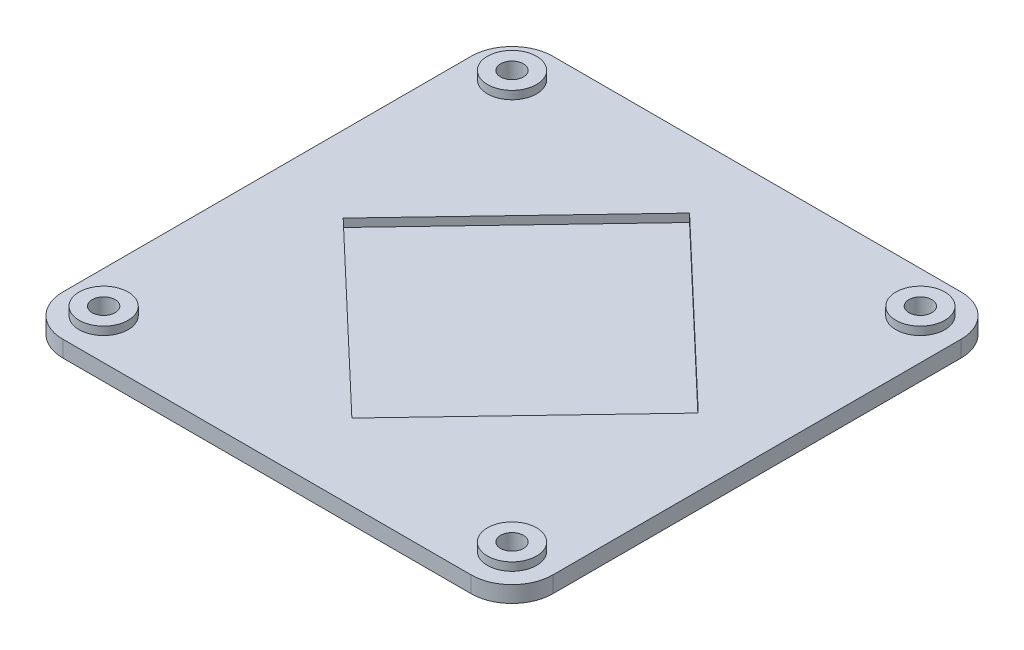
SolidWorks part; units mm, degrees
ref_plane "前视基准面" through (0, 0, 0) normal (0, 0, 1) x (1, 0, 0)
ref_plane "上视基准面" through (0, 0, 0) normal (0, 1, 0) x (1, 0, 0)
ref_plane "右视基准面" through (0, 0, 0) normal (1, 0, 0) x (0, 0, -1)
other "Configuration Table"
sketch "草图1" plane through (0, 0, 0) normal (0, 1, 0) x (1, 0, 0)
  line L1 (-30, 30) -> (30, 30)
  line L2 (-30, 30) -> (-30, -30)
  line L3 (-30, -30) -> (30, -30)
  line L4 (30, 30) -> (30, -30)
  line L5 (-30, 30) -> (30, -30) construction
  line L6 (-30, -30) -> (30, 30) construction
  point P0 (0, 0)
  dimension "D1" = 60
  dimension "D2" = 60
extrude "凸台-拉伸1" add sketch "草图1" along normal blind 2
fillet "圆角1" radius 5 4 edges at (30, 1, -30) (30, 1, 30) (-30, 1, 30) (-30, 1, -30)
sketch "草图2" plane through (0, 2, 0) normal (0, 1, 0) x (1, 0, 0)
  circle A0 centre (-25, 25) radius 3
  circle A1 centre (0, 0) radius 2.0608 construction
  circle A2 centre (25, 25) radius 3
  circle A3 centre (25, -25) radius 3
  circle A4 centre (-25, -25) radius 3
  point P14 (0, 0)
  dimension "D1" = 6
  dimension "D2" = 25
  dimension "D3" = 25
extrude "凸台-拉伸2" add sketch "草图2" along normal blind 1
sketch "草图3" plane through (0, 3, 0) normal (0, 1, 0) x (1, 0, 0)
  circle A0 centre (-25, 25) radius 1.4
  circle A1 centre (0, 0) radius 1.5251 construction
  circle A2 centre (25, 25) radius 1.4
  circle A3 centre (25, -25) radius 1.4
  circle A4 centre (-25, -25) radius 1.4
  point P15 (0, 0)
  dimension "D1" = 2.8
extrude "切除-拉伸1" cut sketch "草图3" against normal blind 6
sketch "草图6" plane through (0, 2, 0) normal (0, 1, 0) x (1, 0, 0)
  line L0 (0, 21.7394) -> (21.7394, 1.0658)
  line L1 (21.7394, 1.0658) -> (1.0658, -20.6736)
  line L2 (1.0658, -20.6736) -> (-20.6736, 0)
  line L3 (-20.6736, 0) -> (0, 21.7394)
  line L4 (0, 0) -> (6.0724, 0) construction
  line L5 (0, 0) -> (0, 8.2297) construction
  dimension "D1" = 90
  dimension "D2" = 90
  dimension "D3" = 90
  dimension "D4" = 30
  dimension "D5" = 30
extrude "切除-拉伸3" cut sketch "草图6" against normal blind 1
